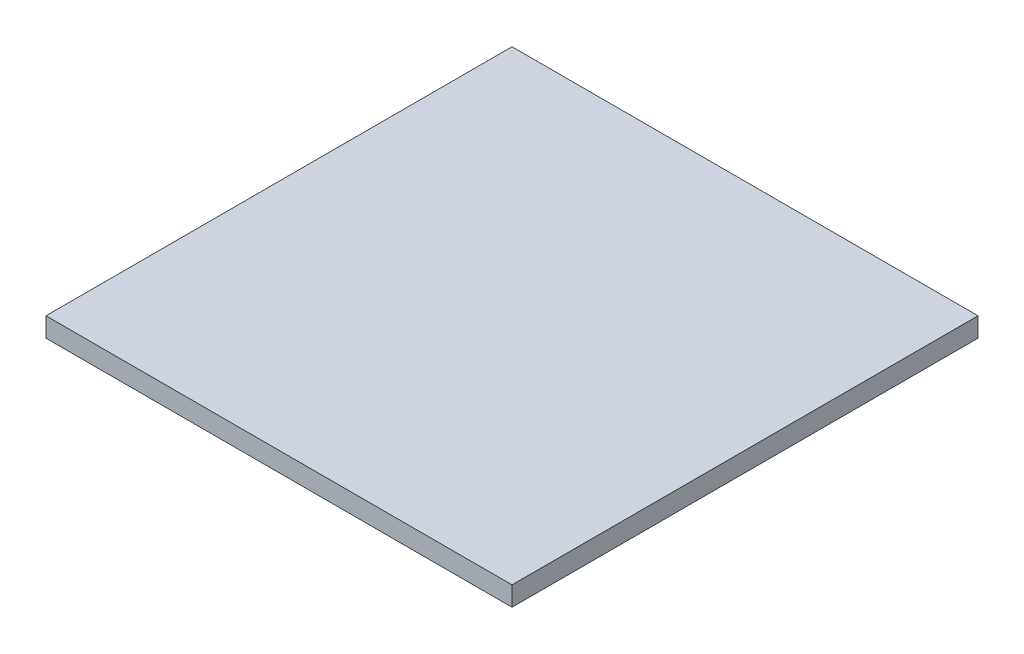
SolidWorks part; units mm, degrees
ref_plane "Front Plane" through (0, 0, 0) normal (0, 0, 1) x (1, 0, 0)
ref_plane "Top Plane" through (0, 0, 0) normal (0, 1, 0) x (1, 0, 0)
ref_plane "Right Plane" through (0, 0, 0) normal (1, 0, 0) x (0, 0, -1)
sketch "Sketch1" plane through (0, 0, 0) normal (0, 1, 0) x (1, 0, 0)
  line L1 (-1828.8, -1828.8) -> (1828.8, -1828.8)
  line L2 (-1828.8, -1828.8) -> (-1828.8, 1828.8)
  line L3 (-1828.8, 1828.8) -> (1828.8, 1828.8)
  line L4 (1828.8, -1828.8) -> (1828.8, 1828.8)
  line L5 (-1828.8, -1828.8) -> (1828.8, 1828.8) construction
  line L6 (-1828.8, 1828.8) -> (1828.8, -1828.8) construction
  point P0 (0, 0)
  dimension "D1" = 3657.6
  dimension "D2" = 3657.6
extrude "Boss-Extrude1" add sketch "Sketch1" along normal blind 152.4
